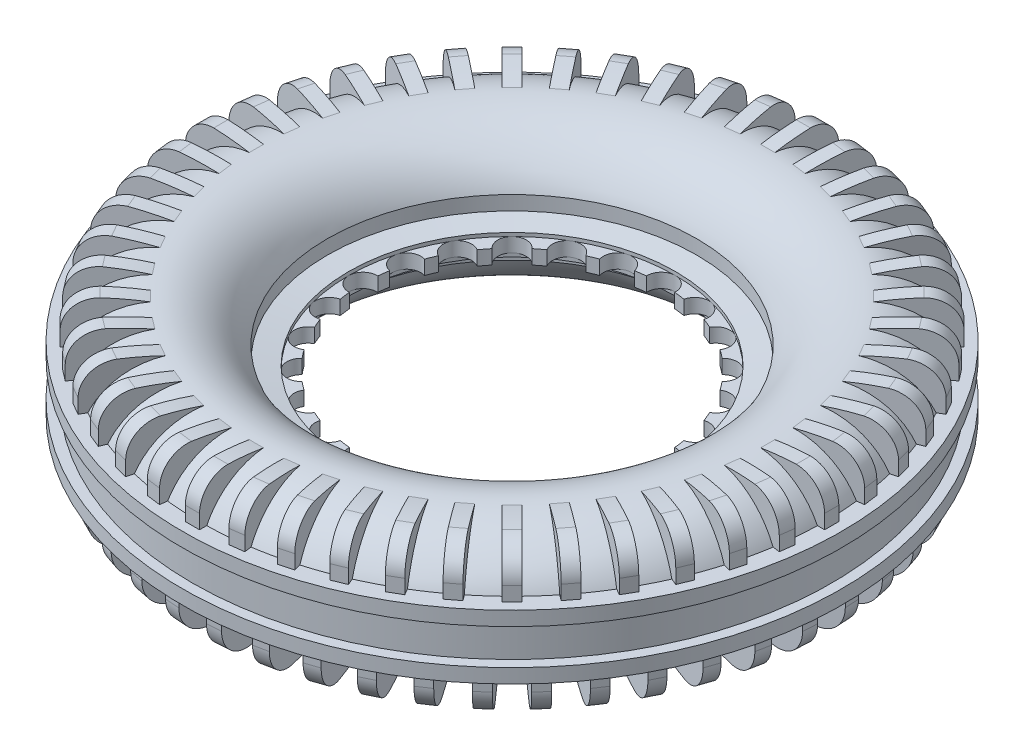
SolidWorks part; units mm, degrees
ref_plane "前视基准面" through (0, 0, 0) normal (0, 0, 1) x (1, 0, 0)
ref_plane "上视基准面" through (0, 0, 0) normal (0, 1, 0) x (1, 0, 0)
ref_plane "右视基准面" through (0, 0, 0) normal (1, 0, 0) x (0, 0, -1)
sketch "草图1" plane through (0, 0, 0) normal (0, 1, 0) x (1, 0, 0)
  circle A0 centre (0, 0) radius 18
  dimension "D1" = 36
sketch "草图2" plane through (0, 0, 0) normal (0, 0, 1) x (1, 0, 0)
  line L0 (0, 0) -> (-22, 0) construction
  line L1 (18, 0) -> (-18, 0) construction
  line L2 (-22, 0) -> (-22, 2.25) construction
  line L3 (0, 0) -> (0, 2) construction
  line L4 (0, 2) -> (-13, 2) construction
  line L5 (0, 0) -> (-18, 0) construction
  line L6 (-18, 0) -> (-18, 5) construction
  line L7 (-13, 2) -> (-13, 1)
  line L8 (-13, 1) -> (-11.5, 0.75)
  line L9 (-11.5, 0.75) -> (-11.5, 0) construction
  line L10 (-11.5, 0.75) -> (0, 0.75)
  line L11 (0, 0.75) -> (0, -0.75)
  line L12 (-22, 2.25) -> (-23.2, 2.25)
  line L13 (-23.2, 2.25) -> (-23.2, 1.25)
  line L14 (-23.2, 1.25) -> (-22.5, 1.25)
  line L15 (-22.5, 1.25) -> (-22.5, -1.25)
  line L16 (-11.5, -0.75) -> (0, -0.75)
  line L17 (-13, -1) -> (-11.5, -0.75)
  line L18 (-13, -2) -> (-13, -1)
  line L19 (-22, -2.25) -> (-23.2, -2.25)
  line L20 (-23.2, -2.25) -> (-23.2, -1.25)
  line L21 (-23.2, -1.25) -> (-22.5, -1.25)
  arc A0 (-13, 2) -> (-22, 2.25) centre (-17.557, 0.0716) ccw
  arc A1 (-13, -2) -> (-22, -2.25) centre (-17.557, -0.0716) cw
  point P28 (-22.5, 0)
  dimension "D1" = 22
  dimension "D2" = 2.25
  dimension "D3" = 2
  dimension "D4" = 13
  dimension "D5" = 18
  dimension "D6" = 5
  dimension "D7" = 1
  dimension "D8" = 0.75
  dimension "D9" = 11.5
  dimension "D10" = 1.2
  dimension "D11" = 1
  dimension "D12" = 0.7
sweep "扫描1" add profiles "草图2" path "草图1"
ref_plane "基准面1" through (22.5, 0, 0) normal (1, 0, 0) x (0, 0, -1)
sketch "草图3" plane through (22.5, 0, 0) normal (1, 0, 0) x (0, 0, -1)
  line L0 (0, 2.25) -> (0, 5.25) construction
  line L1 (23.2, 2.25) -> (-23.2, 2.25) construction
  line L2 (0.5, 2.25) -> (0.5, 5.25)
  line L3 (-0.5, 2.25) -> (-0.5, 5.25)
  line L4 (-0.5, 5.25) -> (0.5, 5.25)
  line L5 (-0.5, 2.25) -> (0.5, 2.25)
  dimension "D1" = 3
  dimension "D2" = 0.5
  dimension "D3" = 0.5
extrude "凸台-拉伸1" add sketch "草图3" against normal blind 4.5
fillet "圆角1" radius 2 1 edges at (22.5, 5.25, 0)
sketch "草图4" plane through (0, 0, 0) normal (0, 1, 0) x (1, 0, 0)
  line L0 (0, 0) -> (22.4518, 1.4716) construction
ref_plane "基准面2" through (22.4518, 0, -1.4716) normal (0.9979, 0, -0.0654) x (-0.0654, 0, -0.9979)
sketch "草图5" plane through (22.4518, 0, -1.4716) normal (0.9979, 0, -0.0654) x (-0.0654, 0, -0.9979)
  line L0 (0, -2.25) -> (0, -5.25) construction
  line L1 (-22, -2.25) -> (22, -2.25) construction
  line L2 (-0.5, -2.25) -> (-0.5, -5.25)
  line L3 (0.5, -2.25) -> (0.5, -5.25)
  line L4 (-0.5, -2.25) -> (0.5, -2.25)
  line L5 (-0.5, -5.25) -> (0.5, -5.25)
  dimension "D1" = 3
  dimension "D2" = 0.5
  dimension "D3" = 0.5
extrude "凸台-拉伸2" add sketch "草图5" against normal blind 4.5
fillet "圆角4" radius 2 1 edges at (22.4518, -5.25, -1.4716)
sketch "草图6" plane through (0, 0, 0.5) normal (0, 0, 1) x (1, 0, 0)
  line L0 (18, 4.9994) -> (18, 5.25)
  line L1 (18, 5.25) -> (20.5, 5.25)
  arc A0 (20.5, 5.25) -> (18, 4.9994) centre (21.2411, -14.7363) ccw
  dimension "D1" = 40
extrude "切除-拉伸1" cut sketch "草图6" against normal blind 1
sketch "草图7" plane through (0.0327, 0, 0.4989) normal (0.0654, 0, 0.9979) x (0.9979, 0, -0.0654)
  line L0 (18, -4.9994) -> (18, -5.25)
  line L1 (18, -5.25) -> (20.5, -5.25)
  arc A0 (18, -4.9994) -> (20.5, -5.25) centre (21.2411, 14.7363) ccw
  dimension "D1" = 40
extrude "切除-拉伸3" cut sketch "草图7" against normal blind 1
pattern_circular "阵列(圆周)3" count 48 over 360 about axis through (0, 0, 0) along (0, 1, 0) of "凸台-拉伸1", "圆角1", "凸台-拉伸2", "圆角4", "切除-拉伸1", "切除-拉伸3"
sketch "草图8" plane through (0, 0.75, 0) normal (0, 1, 0) x (1, 0, 0)
  circle A0 centre (0, 0) radius 11.5
extrude "切除-拉伸4" cut sketch "草图8" against normal blind 0.25
mirror "镜向1" about plane through (0, 0, 0) normal (0, 1, 0) of "切除-拉伸4"
sketch "草图9" plane through (0, 0.5, 0) normal (0, 1, 0) x (1, 0, 0)
  circle A0 centre (0, 0) radius 10.5
  dimension "D1" = 21
extrude "切除-拉伸5" cut sketch "草图9" against normal through all
sketch "草图10" plane through (0, 0.5, 0) normal (0, 1, 0) x (1, 0, 0)
  circle A0 centre (0, 10.5) radius 1
  circle A1 centre (0, 0) radius 10.5 construction
  dimension "D1" = 2
extrude "切除-拉伸6" cut sketch "草图10" against normal through all
pattern_circular "阵列(圆周)4" count 24 over 360 about axis through (0, 0, 0) along (0, 1, 0) of "切除-拉伸6"
